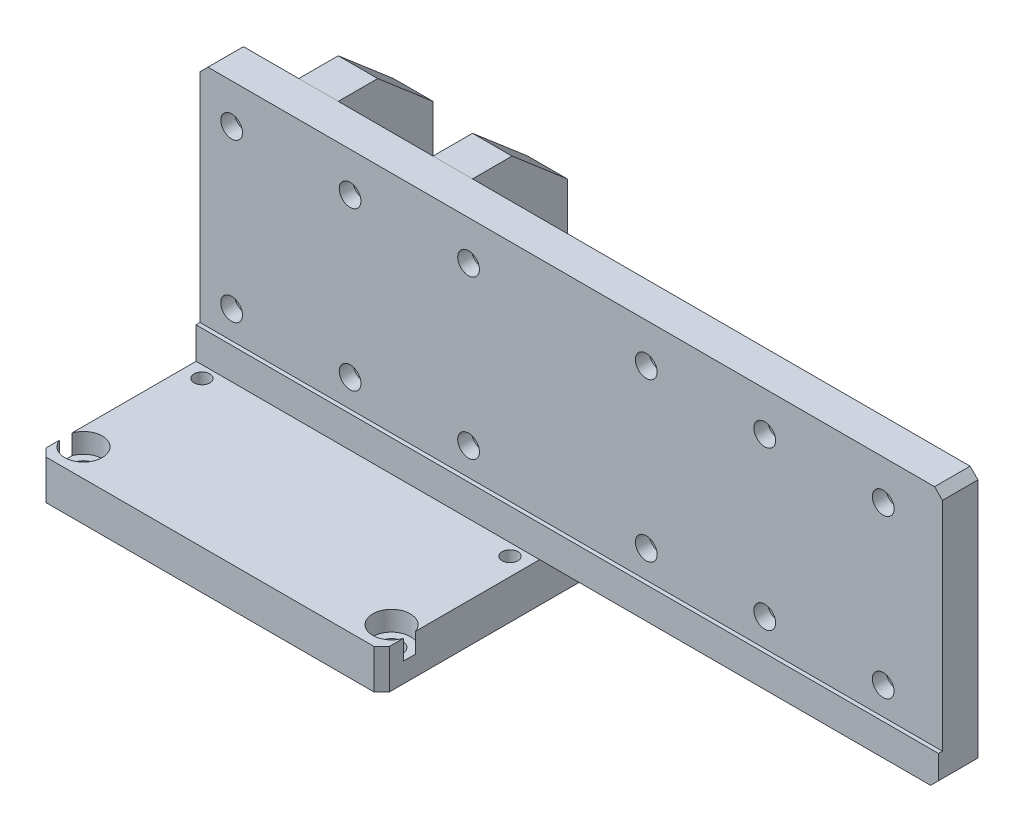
SolidWorks part; units mm, degrees
ref_plane "정면" through (0, 0, 0) normal (0, 0, 1) x (1, 0, 0)
ref_plane "윗면" through (0, 0, 0) normal (0, 1, 0) x (1, 0, 0)
ref_plane "우측면" through (0, 0, 0) normal (1, 0, 0) x (0, 0, -1)
sketch "스케치1" plane through (0, 0, 0) normal (0, 1, 0) x (1, 0, 0)
  line L1 (-43.5, 37) -> (43.5, 37)
  line L2 (-43.5, 37) -> (-43.5, -37)
  line L3 (-43.5, -37) -> (43.5, -37)
  line L4 (43.5, 37) -> (43.5, -37)
  line L5 (-43.5, 37) -> (43.5, -37) construction
  line L6 (-43.5, -37) -> (43.5, 37) construction
  point P0 (0, 0)
  dimension "D1" = 87
  dimension "D2" = 74
extrude "보스-돌출1" add sketch "스케치1" along normal blind 10
sketch "스케치2" plane through (0, 10, 0) normal (0, 1, 0) x (1, 0, 0)
  line L0 (-43.5, 37) -> (-43.5, -37) construction
  line L1 (-43.5, 13) -> (144.5, 13)
  line L2 (-43.5, 13) -> (-43.5, 3)
  line L3 (-43.5, 3) -> (144.5, 3)
  line L4 (144.5, 13) -> (144.5, 3)
  line L5 (43.5, 37) -> (-43.5, 37) construction
  dimension "D1" = 188
  dimension "D2" = 10
  dimension "D3" = 24
extrude "보스-돌출2" add sketch "스케치2" along normal blind 65 separate body
sketch "스케치3" plane through (0, 0, -3) normal (0, 0, 1) x (1, 0, 0)
  line L0 (144.5, 75) -> (144.5, 10) construction
  line L1 (-43.5, 75) -> (144.5, 75)
  line L2 (-43.5, 75) -> (-43.5, 18)
  line L3 (-43.5, 18) -> (144.5, 18)
  line L4 (144.5, 75) -> (144.5, 18)
  line L5 (-43.5, 10) -> (144.5, 10) construction
  dimension "D1" = 8
extrude "컷-돌출1" cut sketch "스케치3" against normal blind 1
sketch "스케치4" plane through (0, 10, 0) normal (0, 1, 0) x (1, 0, 0)
  line L11 (43.5, 37) -> (-43.5, 37) construction
  line L12 (-27.5, 37) -> (-17.5, 37)
  line L13 (-27.5, 37) -> (-27.5, 13)
  line L14 (-27.5, 13) -> (-17.5, 13)
  line L15 (-17.5, 37) -> (-17.5, 13)
  line L16 (144.5, 13) -> (-43.5, 13) construction
  line L17 (-43.5, 37) -> (-43.5, -37) construction
  line L18 (6.5, 37) -> (16.5, 37)
  line L19 (6.5, 37) -> (6.5, 13)
  line L20 (6.5, 13) -> (16.5, 13)
  line L21 (16.5, 37) -> (16.5, 13)
  dimension "D1" = 16
  dimension "D2" = 10
  dimension "D3" = 24
extrude "보스-돌출3" add sketch "스케치4" along normal blind 65 separate body
sketch "스케치5" plane through (16.5, 0, 0) normal (1, 0, 0) x (0, 0, -1)
  line L0 (37, 75) -> (23, 75)
  line L1 (13, 75) -> (37, 75) construction
  line L2 (23, 75) -> (37, 63)
  line L3 (37, 75) -> (37, 10) construction
  line L4 (37, 63) -> (37, 75)
  dimension "D1" = 14
  dimension "D2" = 12
extrude "컷-돌출2" cut sketch "스케치5" against normal through all
hole_wizard "M5 소켓 머리 캡 나사용 카운터보어1" positions "스케치6" profile "스케치7" counterbore size "M5" standard "KS"
sketch "스케치6" plane through (0, 10, 0) normal (0, 1, 0) x (1, 0, 0)
  line L0 (43.5, 37) -> (-43.5, 37) construction
  line L1 (-43.5, 37) -> (-43.5, -37) construction
  point P0 (-39, 30)
  point P2 (39, 30)
  point P4 (-39, -30)
  point P6 (39, -30)
  dimension "D1" = 7
  dimension "D2" = 60
  dimension "D3" = 4.5
  dimension "D4" = 78
sketch "스케치7" plane through (-39, 10, -30) normal (1, 0, 0) x (0, 0, 1)
  line L0 (0, 0) -> (0, 10)
  line L1 (0, 10) -> (2.75, 10)
  line L3 (2.75, 10) -> (2.75, 5)
  line L4 (2.75, 5) -> (4.75, 5)
  line L5 (4.75, 5) -> (4.75, 0)
  line L7 (4.75, 0) -> (0, 0)
  line L11 (0, -6.35) -> (0, 107.95) construction
  dimension "관통 구멍 지름" = 5.5
  dimension "관통 구멍 깊이" = 10
  dimension "카운터보어 지름" = 9.5
  dimension "카운터보어 깊이" = 5
hole_wizard "Ø4.0mm 맞춤핀 구멍1" positions "스케치8" profile "스케치9" hole size "Ø4.0" standard "ISO"
sketch "스케치8" plane through (0, 10, 0) normal (0, 1, 0) x (1, 0, 0)
  line L0 (-43.5, 28.4793) -> (-43.5, -28.4793) construction
  line L2 (-43.5, -37) -> (43.5, -37) construction
  point P0 (-39, 0)
  point P2 (39, 0)
  dimension "D1" = 78
  dimension "D2" = 4.5
  dimension "D3" = 37
sketch "스케치9" plane through (-39, 10, 0) normal (1, 0, 0) x (0, 0, 1)
  line L0 (0, 0) -> (0, 10)
  line L1 (0, 10) -> (2, 10)
  line L2 (2, 10) -> (2, 0)
  line L5 (2, 0) -> (0, 0)
  line L11 (0, -6.35) -> (0, 107.95) construction
  dimension "관통 구멍 지름" = 4
  dimension "관통 구멍 깊이" = 10
hole_wizard "M5 소켓 머리 캡 나사용 카운터보어2" positions "스케치10" profile "스케치11" counterbore size "M5" standard "KS"
sketch "스케치10" plane through (0, 0, -13) normal (0, 0, -1) x (-1, 0, 0)
  line L3 (-144.5, 10) -> (43.5, 10) construction
  line L4 (43.5, 75) -> (43.5, 10) construction
  point P42 (35.5, 65)
  point P44 (5.5, 65)
  point P46 (-24.5, 65)
  point P48 (-24.5, 25)
  point P50 (5.5, 25)
  point P52 (35.5, 25)
  dimension "D1" = 40
  dimension "D2" = 15
  dimension "D3" = 8
  dimension "D4" = 30
  dimension "D5" = 30
sketch "스케치11" plane through (-35.5, 65, -13) normal (1, 0, 0) x (0, 1, 0)
  line L0 (0, 0) -> (0, 50)
  line L1 (0, 50) -> (2.75, 50)
  line L3 (2.75, 50) -> (2.75, 5.5)
  line L4 (2.75, 5.5) -> (4.75, 5.5)
  line L5 (4.75, 5.5) -> (4.75, 0)
  line L7 (4.75, 0) -> (0, 0)
  line L11 (0, -6.35) -> (0, 107.95) construction
  dimension "관통 구멍 지름" = 5.5
  dimension "관통 구멍 깊이" = 50
  dimension "카운터보어 지름" = 9.5
  dimension "카운터보어 깊이" = 5.5
chamfer "모따기1" distance 2 angle 45 3 edges at (144.5, 10, -8) (144.5, 75, -8.5) (-43.5, 75, -8.5)
chamfer "모따기2" distance 2 angle 45 4 edges at (-43.5, 5, -37) (43.5, 5, -37) (43.5, 5, 37) (-43.5, 5, 37)
pattern_linear "선형 패턴1" count 2 spacing 105 along (1, 0, 0) of "M5 소켓 머리 캡 나사용 카운터보어2"
